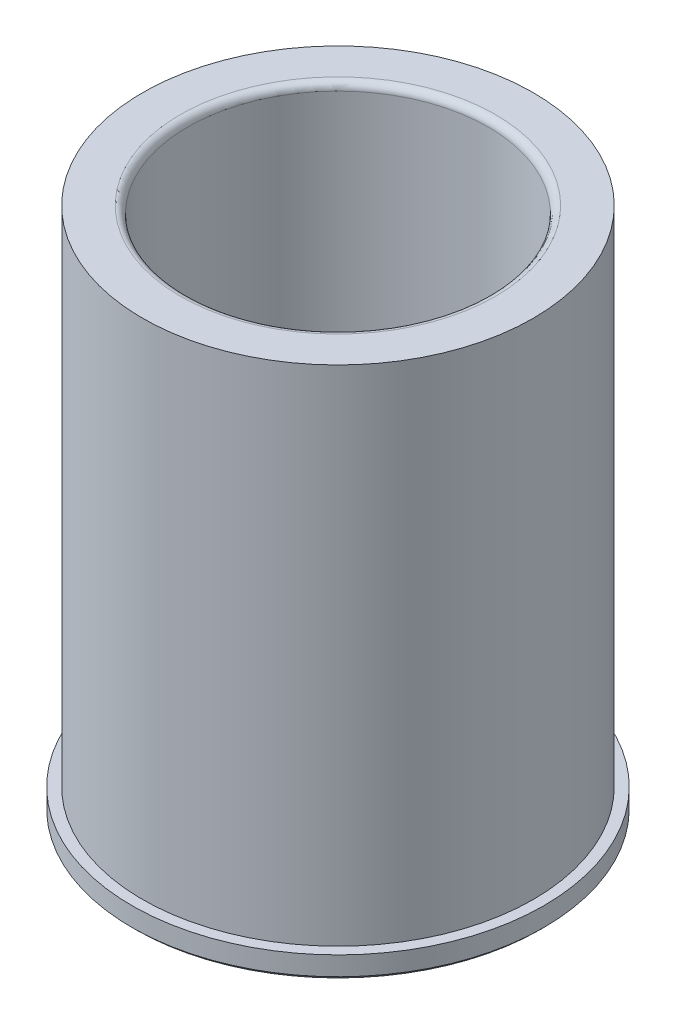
SolidWorks part; units mm, degrees
ref_plane "Front Plane" through (0, 0, 0) normal (0, 0, 1) x (1, 0, 0)
ref_plane "Top Plane" through (0, 0, 0) normal (0, 1, 0) x (1, 0, 0)
ref_plane "Right Plane" through (0, 0, 0) normal (1, 0, 0) x (0, 0, -1)
sketch "Sketch1" plane through (0, 0, 0) normal (0, 0, 1) x (1, 0, 0)
  line L0 (-42.7609, 0) -> (-43.5229, 0.762)
  line L1 (0, -1000) -> (0, 49000) construction
  line L2 (-31.7564, 111.125) -> (-31.7563, 0.762)
  line L3 (-32.5183, 0) -> (-42.7609, 0)
  line L4 (-43.5229, 0.762) -> (-43.5229, 4.7625)
  line L5 (-43.5229, 4.7625) -> (-41.2813, 4.7625)
  line L6 (-41.2814, 111.125) -> (-41.2813, 4.7625)
  line L7 (-41.2814, 111.125) -> (-31.7564, 111.125)
  line L8 (-32.5183, 0) -> (-31.7563, 0.762)
  dimension "OD" = 82.5627
  dimension "ID" = 63.5127
  dimension "H" = 87.0458
  dimension "D2" = 45
  dimension "OVERALL LENGTH" = 111.125
  dimension "D4" = 0.762
  dimension "D5" = 135
  dimension "T" = 4.7625
revolve "Revolve1" add sketch "Sketch1" angle 360 about L1
fillet "Fillet1" radius 1.524 1 edges at (31.7563, 111.125, 0)
